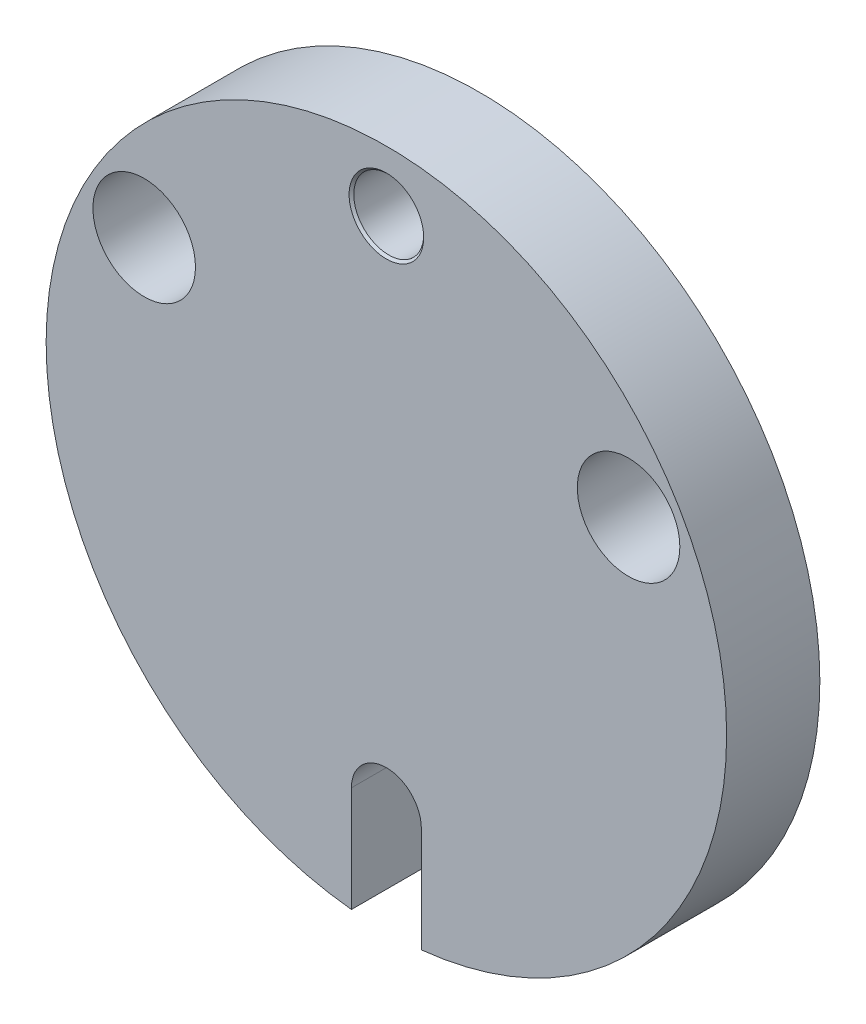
SolidWorks part; units mm, degrees
ref_plane "Front" through (0, 0, 0) normal (0, 0, 1) x (1, 0, 0)
ref_plane "Top" through (0, 0, 0) normal (0, 1, 0) x (1, 0, 0)
ref_plane "Right" through (0, 0, 0) normal (1, 0, 0) x (0, 0, -1)
sketch "Sketch1" plane through (0, 0, 0) normal (0, 0, 1) x (1, 0, 0)
  circle A0 centre (0, 0) radius 7.3
  dimension "D1" = 14.6
extrude "Extrude1" add sketch "Sketch1" along normal blind 2
sketch "Sketch2" plane through (0, 0, 2) normal (0, 0, 1) x (1, 0, 0)
  line L0 (0, 0) -> (0, 6) construction
  line L1 (0, 0) -> (-5.1962, 3) construction
  line L2 (0, 0) -> (5.1962, 3) construction
  circle A0 centre (0, 6) radius 0.75
  circle A1 centre (-5.1962, 3) radius 1.1
  circle A2 centre (5.1962, 3) radius 1.1
  dimension "D2" = 1.5
  dimension "D3" = 2.2
  dimension "D1" = 6
  dimension "D4" = 60
  dimension "D5" = 60
  dimension "D6" = 6
extrude "Cut-Extrude3" cut sketch "Sketch2" against normal blind 2
sketch "Sketch3" plane through (0, 0, 2) normal (0, 0, 1) x (1, 0, 0)
  line L0 (0, 0) -> (0, -5) construction
  line L1 (-0.75, -5) -> (-0.75, -11.2697)
  line L2 (0, -5) -> (0.75, -5) construction
  line L3 (0, -5) -> (-0.75, -5) construction
  line L4 (0.75, -5) -> (0.75, -11.2697)
  line L5 (0.75, -11.2697) -> (-0.75, -11.2697)
  arc A0 (0.75, -5) -> (-0.75, -5) centre (0, -5) ccw
  dimension "D1" = 1.5
  dimension "D2" = 5
extrude "Cut-Extrude4" cut sketch "Sketch3" against normal through all
sketch "Sketch4" plane through (0, 0, 0) normal (0, 0, -1) x (-1, 0, 0)
  circle A0 centre (0, 0) radius 2.5
  dimension "D1" = 5
extrude "Extrude2" add sketch "Sketch4" along normal blind 0.5 draft 20
sketch "Sketch5" plane through (0, 0, -0.5) normal (0, 0, -1) x (-1, 0, 0)
  circle A0 centre (0, 0) radius 1.5
  dimension "D1" = 3
extrude "Cut-Extrude5" cut sketch "Sketch5" against normal blind 2 draft 45
chamfer "Chamfer1" distance 0.05 angle 45 2 edges at (0.75, 6, 2) (0.75, 6, 0)
